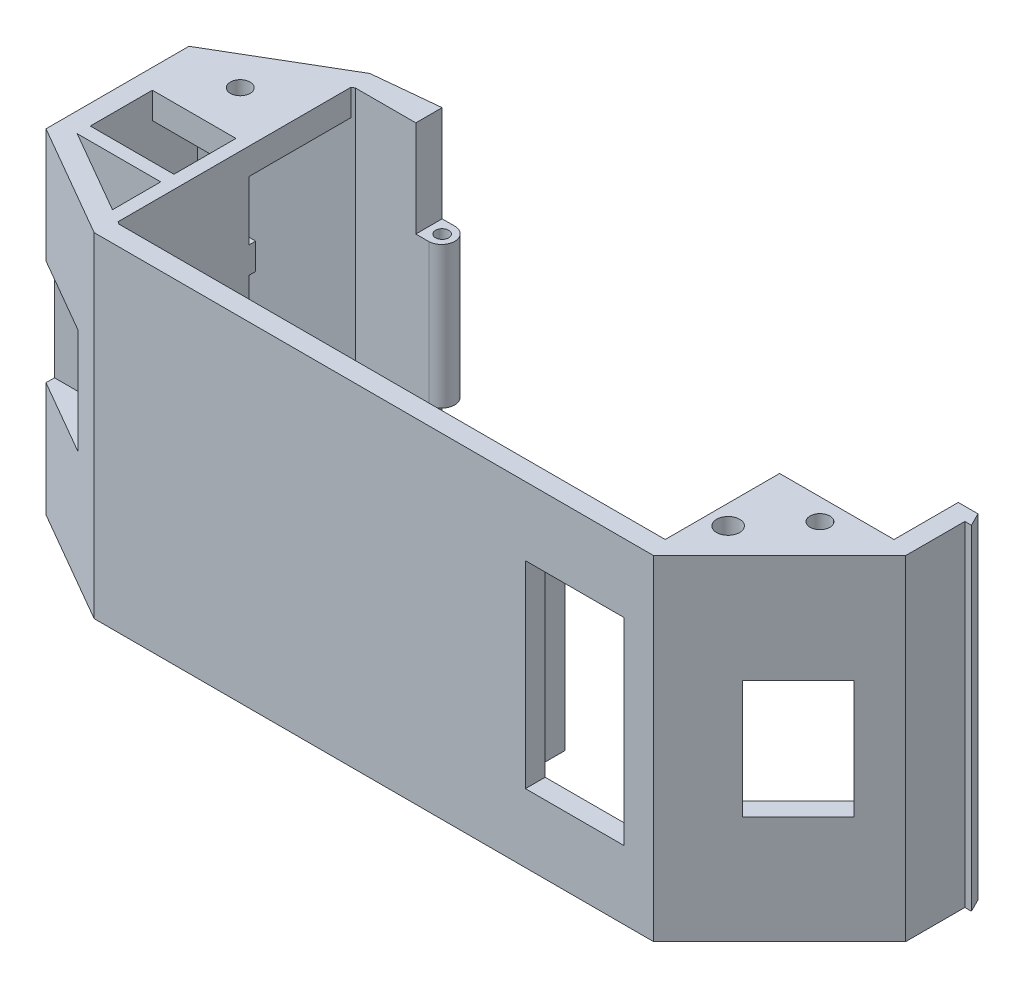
SolidWorks part; units mm, degrees
ref_plane "Front Plane" through (0, 0, 0) normal (0, 0, 1) x (1, 0, 0)
ref_plane "Top Plane" through (0, 0, 0) normal (0, 1, 0) x (1, 0, 0)
ref_plane "Right Plane" through (0, 0, 0) normal (1, 0, 0) x (0, 0, -1)
sketch "Sketch1" plane through (0, 0, 0) normal (0, 1, 0) x (1, 0, 0)
  line L0 (-173.8689, 0) -> (-88.8689, 0)
  line L1 (-88.8689, 0) -> (-69.7289, 19.14)
  line L2 (-173.8689, 0) -> (-191.1894, 10)
  line L3 (-191.1894, 10) -> (-191.1894, 30)
  line L4 (-69.7289, 19.14) -> (-69.7289, 30.14)
  line L5 (-88.8689, 0) -> (-53.1266, 0) construction
  line L6 (-173.8689, 0) -> (-192.7144, 0) construction
  line L7 (-188.1894, 11.7321) -> (-188.1894, 30)
  line L8 (-173.065, 3) -> (-188.1894, 11.7321)
  line L9 (-173.065, 3) -> (-90.1115, 3)
  line L10 (-90.1115, 3) -> (-72.7289, 20.3826)
  line L11 (-72.7289, 20.3826) -> (-72.7289, 30.14)
  line L12 (-188.1894, 30) -> (-173.065, 38.8782)
  line L13 (-69.7289, 30.14) -> (-72.7289, 30.14)
  line L14 (-163.8805, 38.8782) -> (-163.8805, 41.8782)
  line L15 (-173.065, 38.8782) -> (-163.8805, 38.8782)
  line L16 (-191.1894, 30) -> (-191.1894, 31.712)
  line L17 (-173.8805, 41.8782) -> (-191.0765, 31.7839)
  line L18 (-163.8805, 41.8782) -> (-163.8805, 42.8782)
  line L19 (-163.8805, 42.8782) -> (-173.8805, 41.8782)
  line L20 (-191.0765, 31.7839) -> (-191.1894, 31.712)
  dimension "D1" = 85
  dimension "D2" = 27.068
  dimension "D3" = 20
  dimension "D4" = 11
  dimension "D5" = 20
  dimension "D6" = 30
  dimension "D7" = 45
  dimension "D9" = 3
  dimension "D10" = 3
  dimension "D11" = 10
  dimension "D12" = 1
  dimension "D8" = 3
extrude "Boss-Extrude1" add sketch "Sketch1" along normal blind 50.8
sketch "Sketch5" plane through (0, 0, -3) normal (0, 0, -1) x (-1, 0, 0)
  line L0 (131.5883, 50.8) -> (131.5883, 0) construction
  line L1 (90.1115, 50.8) -> (173.065, 50.8) construction
  line L2 (90.1115, 0) -> (173.065, 0) construction
  line L3 (90.1115, 25.4) -> (131.5883, 25.4) construction
  line L4 (90.1115, 50.8) -> (90.1115, 0) construction
  line L5 (110.8499, 25.4) -> (100.8499, 25.4) construction
  line L7 (108.3499, 40.4) -> (93.3499, 40.4)
  line L8 (108.3499, 40.4) -> (108.3499, 10.4)
  line L9 (108.3499, 10.4) -> (93.3499, 10.4)
  line L10 (93.3499, 40.4) -> (93.3499, 10.4)
  line L11 (108.3499, 40.4) -> (93.3499, 10.4) construction
  line L12 (108.3499, 10.4) -> (93.3499, 40.4) construction
  dimension "D1" = 15
  dimension "D2" = 30
sketch "Sketch6" plane through (-188.1894, 0, 0) normal (1, 0, 0) x (0, 0, -1)
  line L0 (11.7321, 0) -> (30, 0) construction
  line L1 (11.7321, 50.8) -> (13.7321, 50.8)
  line L2 (11.7321, 50.8) -> (11.7321, 0)
  line L3 (11.7321, 0) -> (13.7321, 0)
  line L4 (13.7321, 50.8) -> (13.7321, 0)
  dimension "D1" = 2
extrude "Boss-Extrude2" add sketch "Sketch6" along normal blind 12.7
sketch "Sketch7" plane through (0, 50.8, 0) normal (0, 1, 0) x (1, 0, 0)
  line L0 (-175.4894, 11.7321) -> (-175.4894, 4.3997) construction
  line L1 (-173.065, 3) -> (-188.1894, 11.7321) construction
  line L2 (-175.4894, 4.3997) -> (-173.4894, 3.245) construction
  line L3 (-175.4894, 13.7321) -> (-175.4894, 23.1621) construction
  line L4 (-175.4894, 23.1621) -> (-173.4894, 23.1621) construction
  line L5 (-173.4894, 23.1621) -> (-173.4894, 3.245) construction
  line L6 (-175.4894, 23.1621) -> (-175.4894, 4.3997)
  line L7 (-175.4894, 4.3997) -> (-173.4894, 3.245)
  line L8 (-173.4894, 3.245) -> (-173.4894, 23.1621)
  line L9 (-173.4894, 23.1621) -> (-175.4894, 23.1621)
  dimension "D1" = 2.3094
  dimension "D2" = 9.43
  dimension "D3" = 2
extrude "Boss-Extrude3" add sketch "Sketch7" against normal through all
sketch "Sketch8" plane through (0, 0, -13.7321) normal (0, 0, -1) x (-1, 0, 0)
  line L0 (171.8394, 38.1) -> (171.8394, 25.4) construction
  line L1 (171.8394, 31.75) -> (188.1894, 31.75) construction
  line L2 (188.1894, 0) -> (188.1894, 50.8) construction
  line L3 (171.8394, 25.4) -> (171.8394, 12.7) construction
  line L4 (171.8394, 31.75) -> (175.4894, 31.75) construction
  line L5 (171.8394, 12.7) -> (171.8394, 25.4) construction
  line L6 (171.8394, 38.1) -> (171.8394, 25.4) construction
  line L7 (175.4894, 0) -> (175.4894, 50.8) construction
  line L8 (171.8394, 19.05) -> (188.1894, 19.05) construction
  line L9 (171.8394, 19.05) -> (175.4894, 19.05) construction
  line L11 (188.1894, 31.75) -> (175.4894, 31.75)
  line L12 (188.1894, 31.75) -> (188.1894, 30.7516)
  line L13 (188.1894, 30.7516) -> (175.4894, 30.7516)
  line L14 (175.4894, 31.75) -> (175.4894, 30.7516)
  line L15 (188.1894, 19.05) -> (175.4894, 19.05)
  line L16 (188.1894, 19.05) -> (188.1894, 20.0546)
  line L17 (188.1894, 20.0546) -> (175.4894, 20.0546)
  line L18 (175.4894, 19.05) -> (175.4894, 20.0546)
extrude "Boss-Extrude4" add sketch "Sketch8" along normal blind 9.43
sketch "Sketch9" plane through (0, 31.75, 0) normal (0, 1, 0) x (1, 0, 0)
  line L0 (-188.1894, 13.7321) -> (-175.4894, 23.1621) construction
  circle A0 centre (-181.8394, 18.4471) radius 4
  dimension "D1" = 8
extrude "Cut-Extrude4" cut sketch "Sketch9" against normal blind 13
sketch "Sketch10" plane through (-173.4894, 0, 0) normal (1, 0, 0) x (0, 0, -1)
  line L0 (13.2035, 50.8) -> (13.2035, 0) construction
  line L1 (3.245, 50.8) -> (23.1621, 50.8) construction
  line L2 (3.245, 0) -> (23.1621, 0) construction
  line L3 (13.2035, 0) -> (23.1621, 50.8) construction
  line L4 (23.1621, 50.8) -> (23.1621, 0) construction
  line L5 (23.1621, 0) -> (13.2035, 50.8) construction
  circle A0 centre (18.1828, 25.4) radius 4
  dimension "D1" = 8
extrude "Cut-Extrude5" cut sketch "Sketch10" against normal blind 5
sketch "Sketch11" plane through (-173.4894, 0, 0) normal (1, 0, 0) x (0, 0, -1)
  line L1 (3.245, 0) -> (3.245, 50.8) construction
  line L2 (3.245, 25.4) -> (11.3614, 25.4) construction
  line L3 (3.3182, 33.405) -> (11.2882, 33.405)
  line L4 (3.3182, 33.405) -> (3.3182, 17.395)
  line L5 (3.3182, 17.395) -> (11.2882, 17.395)
  line L6 (11.2882, 33.405) -> (11.2882, 17.395)
  line L7 (3.3182, 33.405) -> (11.2882, 17.395) construction
  line L8 (3.3182, 17.395) -> (11.2882, 33.405) construction
  point P0 (7.3032, 25.4)
  dimension "D1" = 7.97
  dimension "D2" = 16.01
extrude "Cut-Extrude6" cut sketch "Sketch11" against normal blind 20
sketch "Sketch12" plane through (-188.1894, 0, 0) normal (1, 0, 0) x (0, 0, -1)
  line L0 (23.1621, 19.05) -> (23.1621, 13) construction
  line L2 (23.1621, 50.8) -> (23.1621, 37.8) construction
  line L3 (23.1621, 13) -> (24.1621, 13)
  line L4 (23.1621, 31.75) -> (23.1621, 50.8) construction
  line L5 (30, 50.8) -> (30, 0) construction
  line L6 (23.1621, 50.8) -> (30, 50.8)
  line L7 (23.1621, 50.8) -> (23.1621, 46.8)
  line L8 (23.1621, 46.8) -> (30, 46.8)
  line L9 (13.7321, 0) -> (30, 0) construction
  line L10 (23.1621, 0) -> (23.1621, 13) construction
  line L11 (23.1621, 0) -> (30, 0)
  line L12 (23.1621, 0) -> (23.1621, 4)
  line L13 (13.7321, 50.8) -> (30, 50.8) construction
  line L14 (30, 50.8) -> (30, 46.8)
  line L15 (23.1621, 4) -> (30, 4)
  line L16 (23.1621, 37.8) -> (24.1621, 37.8)
  line L17 (23.1621, 37.8) -> (23.1621, 33.8)
  line L18 (23.1621, 33.8) -> (24.1621, 33.8)
  line L19 (24.1621, 37.8) -> (24.1621, 33.8)
  line L20 (30, 0) -> (30, 4)
  line L21 (23.1621, 13) -> (23.1621, 17)
  line L22 (23.1621, 17) -> (24.1621, 17)
  line L23 (24.1621, 13) -> (24.1621, 17)
  dimension "D1" = 4
  dimension "D2" = 13
  dimension "D3" = 4
  dimension "D4" = 13
  dimension "D5" = 4
  dimension "D6" = 4
  dimension "D7" = 1
  dimension "D8" = 1
extrude "Boss-Extrude7" add sketch "Sketch12" along normal up to surface (14.7 mm away)
sketch "Sketch26" plane through (-163.8805, 0, 0) normal (1, 0, 0) x (0, 0, -1)
  line L0 (38.8782, 25.4) -> (42.8782, 25.4) construction
  line L2 (38.8782, 50.8) -> (38.8782, 0) construction
  line L3 (42.8782, 50.8) -> (42.8782, 0) construction
  line L5 (38.8782, 36.1685) -> (42.8782, 36.1685)
  line L6 (38.8782, 36.1685) -> (38.8782, 14.6315)
  line L7 (38.8782, 14.6315) -> (42.8782, 14.6315)
  line L8 (42.8782, 36.1685) -> (42.8782, 14.6315)
  line L9 (38.8782, 36.1685) -> (42.8782, 14.6315) construction
  line L10 (38.8782, 14.6315) -> (42.8782, 36.1685) construction
  point P8 (40.8782, 25.4)
extrude "Boss-Extrude11" add sketch "Sketch26" along normal blind 4
sketch "Sketch28" plane through (-69.7289, 0, 0) normal (1, 0, 0) x (0, 0, -1)
  line L0 (19.14, 0) -> (30.14, 0) construction
  line L1 (30.14, 50.8) -> (28.14, 50.8)
  line L2 (30.14, 0) -> (30.1421, -0.0192) construction
  line L3 (30.14, 50.8) -> (30.14, 0)
  line L4 (30.14, 0) -> (28.14, 0)
  line L5 (28.14, 50.8) -> (28.14, 0)
  dimension "D1" = 2
sketch "Sketch30" plane through (0, 36.1685, 0) normal (0, 1, 0) x (1, 0, 0)
  line L0 (-159.8805, 42.8782) -> (-163.8805, 42.8782) construction
  line L1 (-159.8805, 38.8782) -> (-163.8805, 38.8782) construction
  line L2 (-161.8805, 42.8782) -> (-159.8805, 42.8782)
  line L3 (-159.8805, 42.8782) -> (-159.8805, 38.8782)
  line L4 (-159.8805, 38.8782) -> (-161.8805, 38.8782)
  line L6 (-161.8805, 38.8782) -> (-151.874, 38.8771) construction
  line L7 (-161.8805, 42.8782) -> (-161.8805, 41.8782) construction
  arc A0 (-161.8805, 42.8782) -> (-161.8805, 38.8782) centre (-161.9673, 40.8782) cw
  circle A1 centre (-161.8805, 40.8782) radius 1
  dimension "D1" = 2
extrude "Cut-Extrude14" cut sketch "Sketch30" against normal blind 22
extrude "Cut-Extrude15" cut sketch "Sketch5" against normal blind 10
sketch "Sketch31" plane through (-44.4344, 0, -44.4344) normal (0.7071, 0, 0.7071) x (0.7071, 0, -0.7071)
  line L1 (-62.8398, 50.8) -> (-35.7718, 50.8) construction
  line L2 (-62.8398, 0) -> (-35.7718, 0) construction
  line L3 (-49.3058, 0) -> (-47.3058, 0) construction
  line L4 (-47.3058, 0) -> (-47.3058, 50.8) construction
  line L5 (-53.3058, 34.4) -> (-41.3058, 34.4)
  line L6 (-53.3058, 34.4) -> (-53.3058, 16.4)
  line L7 (-53.3058, 16.4) -> (-41.3058, 16.4)
  line L8 (-41.3058, 34.4) -> (-41.3058, 16.4)
  line L9 (-53.3058, 34.4) -> (-41.3058, 16.4) construction
  line L10 (-53.3058, 16.4) -> (-41.3058, 34.4) construction
  point P0 (-47.3058, 25.4)
  dimension "D1" = 2
  dimension "D2" = 12
  dimension "D3" = 18
extrude "Cut-Extrude16" cut sketch "Sketch31" against normal blind 8
extrude "Boss-Extrude12" add sketch "Sketch28" along normal blind 1
sketch "Sketch35" plane through (0, 0, -30) normal (0, 0, -1) x (-1, 0, 0)
  line L1 (173.4894, 50.8) -> (188.1894, 50.8)
  line L2 (173.4894, 50.8) -> (173.4894, 46.8)
  line L3 (173.4894, 46.8) -> (188.1894, 46.8)
  line L4 (188.1894, 50.8) -> (188.1894, 46.8)
  line L5 (173.4894, 4) -> (188.1894, 4)
  line L6 (173.4894, 4) -> (173.4894, 0)
  line L7 (173.4894, 0) -> (188.1894, 0)
  line L8 (188.1894, 4) -> (188.1894, 0)
extrude "Boss-Extrude13" add sketch "Sketch35" along normal blind 10
sketch "Sketch36" plane through (0, 50.8, 0) normal (0, 1, 0) x (1, 0, 0)
  line L0 (-188.1894, 33.4787) -> (-177.0801, 40)
  line L1 (-177.0801, 40) -> (-188.1894, 40)
  line L2 (-188.1894, 40) -> (-188.1894, 33.4787)
extrude "Cut-Extrude18" cut sketch "Sketch36" against normal blind 55
sketch "Sketch37" plane through (0, 50.8, 0) normal (0, 1, 0) x (1, 0, 0)
  line L0 (-181.8394, 23.1621) -> (-181.8394, 30.1621) construction
  line L1 (-175.4894, 23.1621) -> (-188.1894, 23.1621) construction
  circle A0 centre (-181.8394, 30.1621) radius 1.5
  dimension "D2" = 3
  dimension "D1" = 7
extrude "Cut-Extrude19" cut sketch "Sketch37" against normal blind 55
sketch3d "3DSketch1"
  line L0 (-90.1115, 50.8, -3) -> (-90.1115, 0, -3) construction
  line L4 (-72.7289, 50.8, -20.3826) -> (-90.1115, 50.8, -3)
  line L5 (-72.7289, 50.8, -20.3826) -> (-72.7289, 45.8, -20.3826)
  line L6 (-72.7289, 45.8, -20.3826) -> (-90.1115, 45.8, -3)
  line L7 (-90.1115, 50.8, -3) -> (-90.1115, 45.8, -3)
  line L8 (-72.7289, 0, -20.3826) -> (-90.1115, 0, -3)
  line L9 (-72.7289, 0, -20.3826) -> (-72.7289, 5, -20.3826)
  line L10 (-72.7289, 5, -20.3826) -> (-90.1115, 5, -3)
  line L11 (-90.1115, 0, -3) -> (-90.1115, 5, -3)
  dimension "D1" = 5
  dimension "D2" = 5
extrude "Boss-Extrude14" add sketch "3DSketch1" along direction (0.7071, 0, 0.7071) on the side of the normal blind 15
sketch "Sketch41" plane through (0, 0, 0) normal (0, -1, 0) x (1, 0, 0)
  line L0 (-90.1115, -3) -> (-90.1115, -20.3826) construction
  line L1 (-72.7289, -20.3826) -> (-90.1115, -20.3826) construction
  line L2 (-72.7289, -20.3826) -> (-83.3355, -30.9892)
  line L3 (-83.3355, -30.9892) -> (-100.7181, -13.6066)
  line L4 (-100.7181, -13.6066) -> (-90.1115, -3)
  line L5 (-90.1115, -3) -> (-90.1115, -20.3826)
  line L6 (-90.1115, -20.3826) -> (-72.7289, -20.3826)
extrude "Cut-Extrude22" cut sketch "Sketch41" against normal blind 55
sketch "Sketch42" plane through (0, 0, 0) normal (0, -1, 0) x (1, 0, 0)
  line L0 (-79.2989, -9.57) -> (-90.1115, -20.3826) construction
  line L1 (-88.8689, 0) -> (-69.7289, -19.14) construction
  line L2 (-84.7052, -14.9763) -> (-87.1214, -9.57) construction
  line L3 (-84.7052, -14.9763) -> (-80.7052, -17.1045) construction
  circle A0 centre (-87.1214, -9.57) radius 1.7526
  circle A1 centre (-80.7052, -17.1045) radius 1.5
  dimension "D1" = 3.5052
  dimension "D3" = 3
  dimension "D2" = 4
extrude "Cut-Extrude23" cut sketch "Sketch42" against normal blind 55
sketch "Sketch43" plane through (0, 50.8, 0) normal (0, 1, 0) x (1, 0, 0)
  line L0 (-68.7289, 30.14) -> (-68.7289, 28.14)
  line L1 (-68.7289, 28.14) -> (-69.7289, 30.14)
  line L2 (-68.7289, 30.14) -> (-72.7289, 30.14) construction
  line L3 (-69.7289, 30.14) -> (-68.7289, 30.14)
extrude "Cut-Extrude24" cut sketch "Sketch43" against normal blind 55
sketch "Sketch44" plane through (0, 0, -3) normal (0, 0, -1) x (-1, 0, 0)
  line L5 (110.3499, 10.4) -> (112.3499, 10.4)
  line L6 (110.3499, 10.4) -> (110.3499, 40.4)
  line L7 (110.3499, 40.4) -> (112.3499, 40.4)
  line L8 (112.3499, 10.4) -> (112.3499, 40.4)
  dimension "D2" = 2
extrude "Boss-Extrude16" add sketch "Sketch44" along normal blind 5
equation "\"2mmmm\"=14.75"
